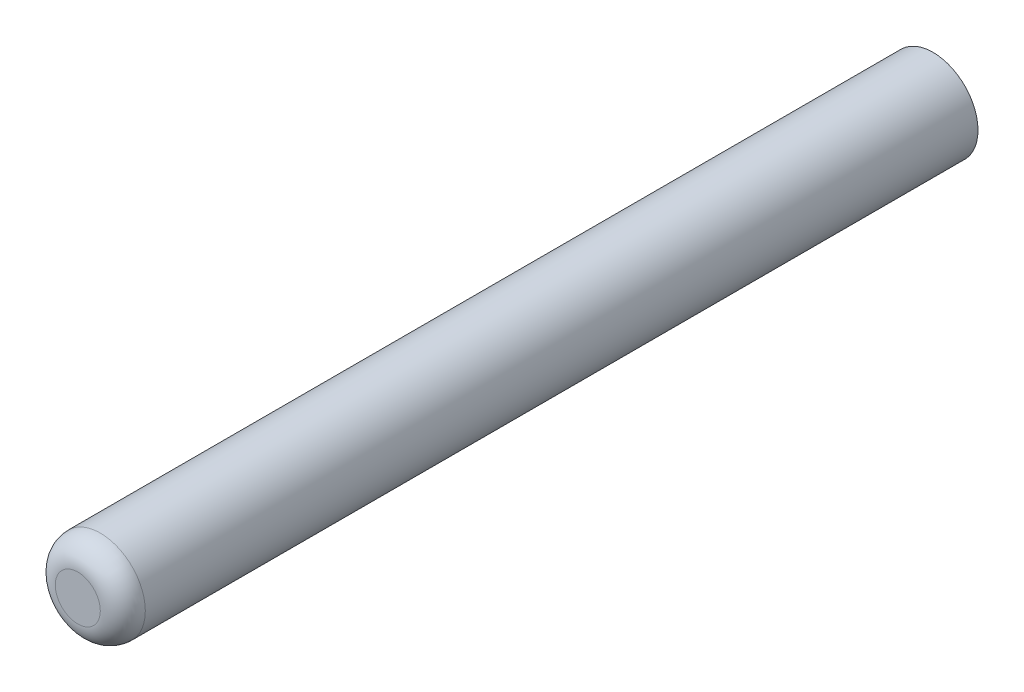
SolidWorks part; units mm, degrees
ref_plane "Face" through (0, 0, 0) normal (0, 0, 1) x (1, 0, 0)
ref_plane "Dessus" through (0, 0, 0) normal (0, 1, 0) x (1, 0, 0)
ref_plane "Droite" through (0, 0, 0) normal (1, 0, 0) x (0, 0, -1)
sketch "Esquisse1" plane through (0, 0, 0) normal (0, 0, 1) x (1, 0, 0)
  circle A0 centre (0, 0) radius 1
  dimension "D1" = 2
extrude "Axe" add sketch "Esquisse1" along normal mid plane 19
fillet "Congé" radius 0.5
